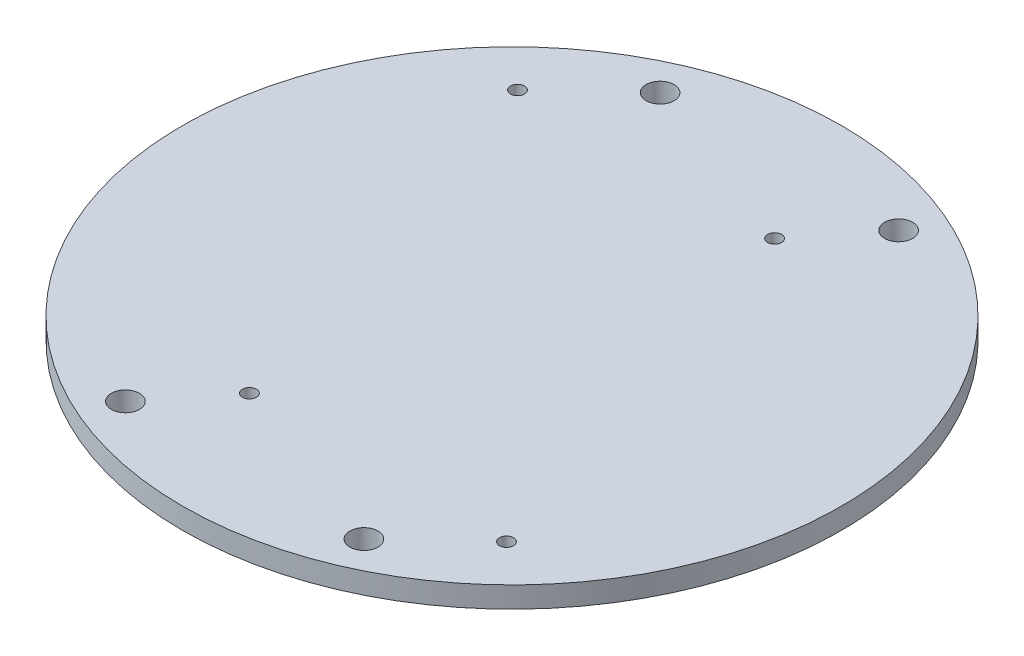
SolidWorks part; units mm, degrees
ref_plane "Front Plane" through (0, 0, 0) normal (0, 0, 1) x (1, 0, 0)
ref_plane "Top Plane" through (0, 0, 0) normal (0, 1, 0) x (1, 0, 0)
ref_plane "Right Plane" through (0, 0, 0) normal (1, 0, 0) x (0, 0, -1)
sketch "Sketch1" plane through (0, 0, 0) normal (0, 1, 0) x (1, 0, 0)
  circle A0 centre (0, 0) radius 47
  dimension "D1" = 94
extrude "Base" add sketch "Sketch1" along normal mid plane 3
sketch "Sketch6" plane through (0, 1.5, 0) normal (0, 1, 0) x (1, 0, 0)
  line L0 (35, 28.2843) -> (-35, 28.2843) construction
  line L1 (-35, 28.2843) -> (-35, -28.2843) construction
  line L2 (-35, -28.2843) -> (35, -28.2843) construction
  line L3 (35, -28.2843) -> (35, 28.2843) construction
  line L4 (27.5, 28.2843) -> (27.5, -28.2843) construction
  line L5 (-27.5, 28.2843) -> (-27.5, -28.2843) construction
  line L6 (0, 28.2843) -> (0, -28.2843) construction
  line L7 (9.1667, 28.2843) -> (9.1667, -28.2843) construction
  line L8 (-9.1667, 28.2843) -> (-9.1667, -28.2843) construction
  line L9 (-5.8578, 18.0745) -> (-44.6629, 5.4981) construction
  line L10 (-44.6629, 5.4981) -> (-32.9473, -30.6508) construction
  line L11 (-9.1667, -28.2843) -> (9.1667, 28.2843) construction
  line L12 (-32.9473, -30.6508) -> (5.8578, -18.0745) construction
  line L13 (27.5, -28.2843) -> (18.3333, -41.0961) construction
  line L14 (-9.1667, 28.2843) -> (9.1667, -28.2843) construction
  line L15 (18.3333, -41.0961) -> (9.1667, -28.2843) construction
  line L16 (0, 0) -> (45, 0) construction
  circle A0 centre (0, 0) radius 45 construction
  circle A1 centre (27.5, -28.2843) radius 1
  circle A2 centre (9.1667, 28.2843) radius 1
  circle A3 centre (-9.1667, -28.2843) radius 1
  circle A4 centre (-27.5, 28.2843) radius 1
  circle A5 centre (17.0093, -38.128) radius 2
  circle A6 centre (17.0093, -38.128) radius 3.25 construction
  circle A7 centre (17.0093, 38.128) radius 2
  circle A8 centre (-17.0093, 38.128) radius 2
  circle A9 centre (-17.0093, -38.128) radius 2
  dimension "D1" = 90
  dimension "D4" = 2
  dimension "D7" = 4
  dimension "D9" = 6.5
  dimension "D2" = 70
  dimension "D3" = 7.5
  dimension "D5" = 18.3333
  dimension "D6" = 38
extrude "Holes Pattern" cut sketch "Sketch6" against normal through all
equation "\"D1@Sketch1\"=\"base diameter@values@params.sldprt\"-2*\"width keep@values@params.sldprt\""
equation "\"D1@Base\"=\"width keep@values@params.sldprt\""
